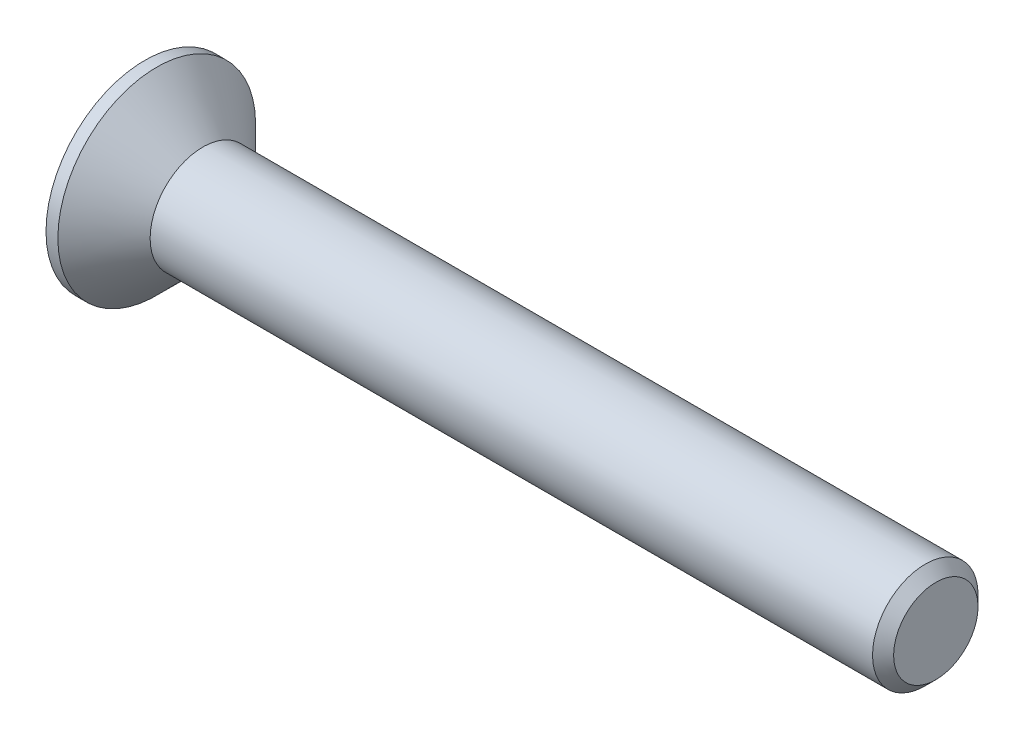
SolidWorks part; units mm, degrees
ref_plane "Front Plane" through (0, 0, 0) normal (0, 0, 1) x (1, 0, 0)
ref_plane "Top Plane" through (0, 0, 0) normal (0, 1, 0) x (1, 0, 0)
ref_plane "Right Plane" through (0, 0, 0) normal (1, 0, 0) x (0, 0, -1)
sketch "Sketch1" plane through (0, 0, 0) normal (0, 0, 1) x (1, 0, 0)
  line L1 (-2.2, 3.75) -> (-2.2, 0)
  line L2 (-2.2, 0) -> (27.8, 0)
  line L3 (27.8, 0) -> (27.8, 2)
  line L4 (27.8, 2) -> (0, 2)
  line L5 (-2.2, 3.75) -> (-1.75, 3.75)
  line L6 (-1.75, 3.75) -> (0, 2)
  dimension "D1" = 2
  dimension "D2" = 45
  dimension "D3" = 2.2
  dimension "D4" = 30
  dimension "D5" = 3.75
revolve "Revolve1" add sketch "Sketch1" angle 360 about L2
chamfer "Chamfer1" distance 0.4 angle 45 1 edges at (27.8, 0, 2)
sketch "Sketch2" plane through (-2.2, 0, 0) normal (-1, 0, 0) x (0, 0, 1)
  line L0 (-0.55, 2.2) -> (0.55, 2.2)
  line L1 (0.55, 2.2) -> (0.55, 0.55)
  line L2 (0.55, 0.55) -> (2.2, 0.55)
  line L3 (2.2, 0.55) -> (2.2, -0.55)
  line L4 (2.2, -0.55) -> (0.55, -0.55)
  line L5 (0.55, -0.55) -> (0.55, -2.2)
  line L6 (0.55, -2.2) -> (-0.55, -2.2)
  line L7 (-0.55, -2.2) -> (-0.55, -0.55)
  line L8 (-0.55, -0.55) -> (-2.2, -0.55)
  line L9 (-2.2, -0.55) -> (-2.2, 0.55)
  line L10 (-2.2, 0.55) -> (-0.55, 0.55)
  line L11 (-0.55, 0.55) -> (-0.55, 2.2)
  point P2 (0, 2.2)
  point P14 (0, -2.2)
  point P15 (2.2, 0)
  point P16 (-2.2, 0)
  dimension "D1" = 4.4
  dimension "D2" = 1.1
extrude "Cut-Extrude1" cut sketch "Sketch2" against normal blind 1.9
